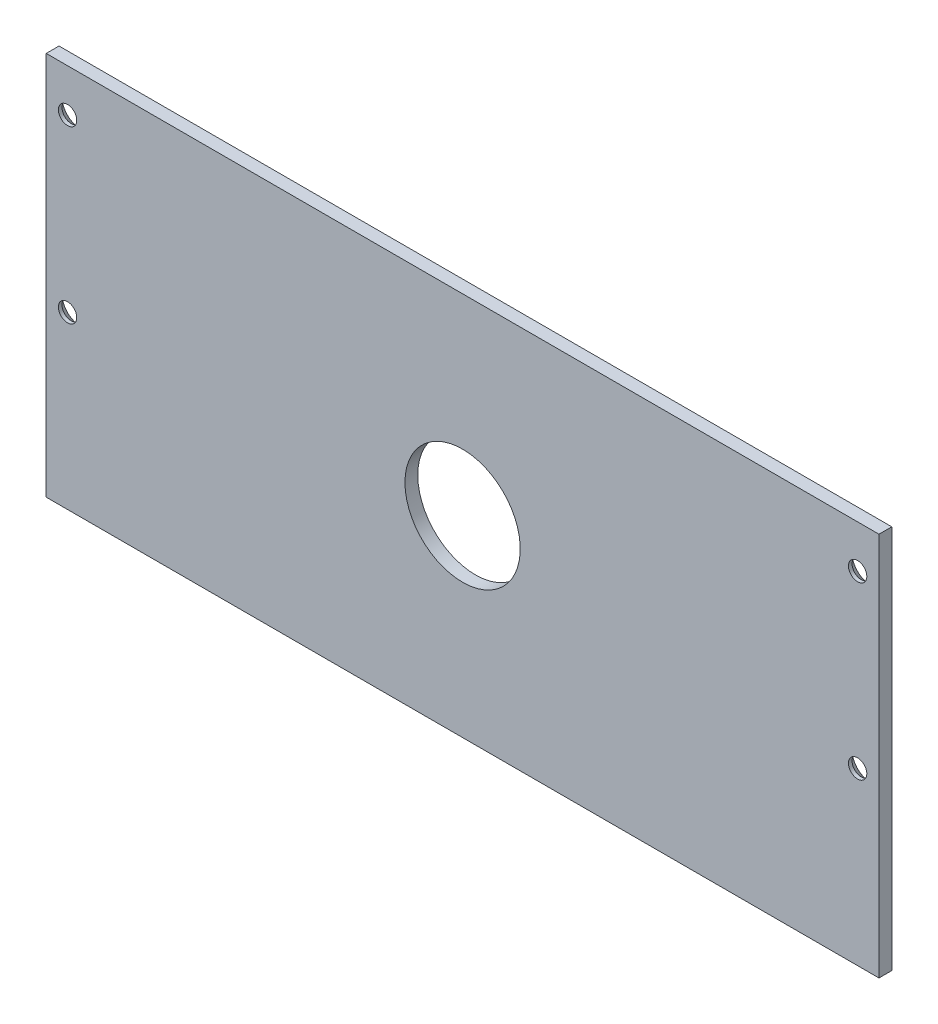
SolidWorks part; units mm, degrees
ref_plane "Спереди" through (0, 0, 0) normal (0, 0, 1) x (1, 0, 0)
ref_plane "Сверху" through (0, 0, 0) normal (0, 1, 0) x (1, 0, 0)
ref_plane "Справа" through (0, 0, 0) normal (1, 0, 0) x (0, 0, -1)
sketch "Эскиз1" plane through (0, 0, 0) normal (0, 0, 1) x (1, 0, 0)
  line L1 (0, 0) -> (195, 0)
  line L2 (0, 0) -> (0, 90)
  line L3 (0, 90) -> (195, 90)
  line L4 (195, 0) -> (195, 90)
  dimension "D1" = 90
  dimension "D2" = 195
extrude "Бобышка-Вытянуть1" add sketch "Эскиз1" along normal blind 3
sketch "Эскиз2" plane through (0, 0, 0) normal (0, 0, -1) x (-1, 0, 0)
  line L0 (-97.5, 105.0306) -> (-97.5, -17.4439) construction
  line L1 (-195, 90) -> (0, 90) construction
  line L2 (-195, 0) -> (-195, 90) construction
  circle A0 centre (-190, 80) radius 4.3
  circle A2 centre (-190, 40) radius 4.3
  circle A3 centre (-5, 80) radius 4.3
  circle A4 centre (-5, 40) radius 4.3
  point P4 (-97.5, 90)
  dimension "D1" = 8.6
  dimension "D2" = 8.6
  dimension "D3" = 8.6
  dimension "D4" = 8.6
  dimension "D5" = 5
  dimension "D6" = 10
  dimension "D7" = 40
extrude "Вырез-Вытянуть1" cut sketch "Эскиз2" against normal blind 2.15
draft "Уклон1" type of draft neutral plane draft angle 45 faces to draft 4 parameters "D1"=45
sketch "Эскиз3" plane through (0, 0, 2.15) normal (0, 0, -1) x (-1, 0, 0)
  circle A0 centre (-190, 80) radius 2.15
  dimension "D1" = 4.3
extrude "Вырез-Вытянуть2" cut sketch "Эскиз3" against normal through all
sketch "Эскиз4" plane through (0, 0, 2.15) normal (0, 0, -1) x (-1, 0, 0)
  circle A0 centre (-190, 40) radius 2.15
  circle A1 centre (-190, 40) radius 2.15 construction
  dimension "D1" = 4.3
extrude "Вырез-Вытянуть3" cut sketch "Эскиз4" against normal through all
sketch "Эскиз5" plane through (0, 0, 2.15) normal (0, 0, -1) x (-1, 0, 0)
  circle A0 centre (-5, 80) radius 2.15
  circle A1 centre (-5, 80) radius 2.15 construction
  dimension "D1" = 4.3
extrude "Вырез-Вытянуть4" cut sketch "Эскиз5" against normal through all
sketch "Эскиз6" plane through (0, 0, 2.15) normal (0, 0, -1) x (-1, 0, 0)
  circle A0 centre (-5, 40) radius 2.15
  circle A1 centre (-5, 40) radius 2.15 construction
  dimension "D1" = 4.3
extrude "Вырез-Вытянуть5" cut sketch "Эскиз6" against normal through all
sketch "Эскиз7" plane through (0, 0, 0) normal (0, 0, -1) x (-1, 0, 0)
  line L0 (-97.5, 97.6729) -> (-97.5, -6.3275) construction
  line L1 (-195, 90) -> (0, 90) construction
  line L2 (-198.5306, 45) -> (27.3402, 45) construction
  line L3 (-195, 0) -> (-195, 90) construction
  circle A0 centre (-97.5, 45) radius 13.5
  point P4 (-97.5, 90)
  point P9 (-195, 45)
  point P10 (-97.5, 45)
  dimension "D1" = 27
extrude "Вырез-Вытянуть6" cut sketch "Эскиз7" against normal through all
